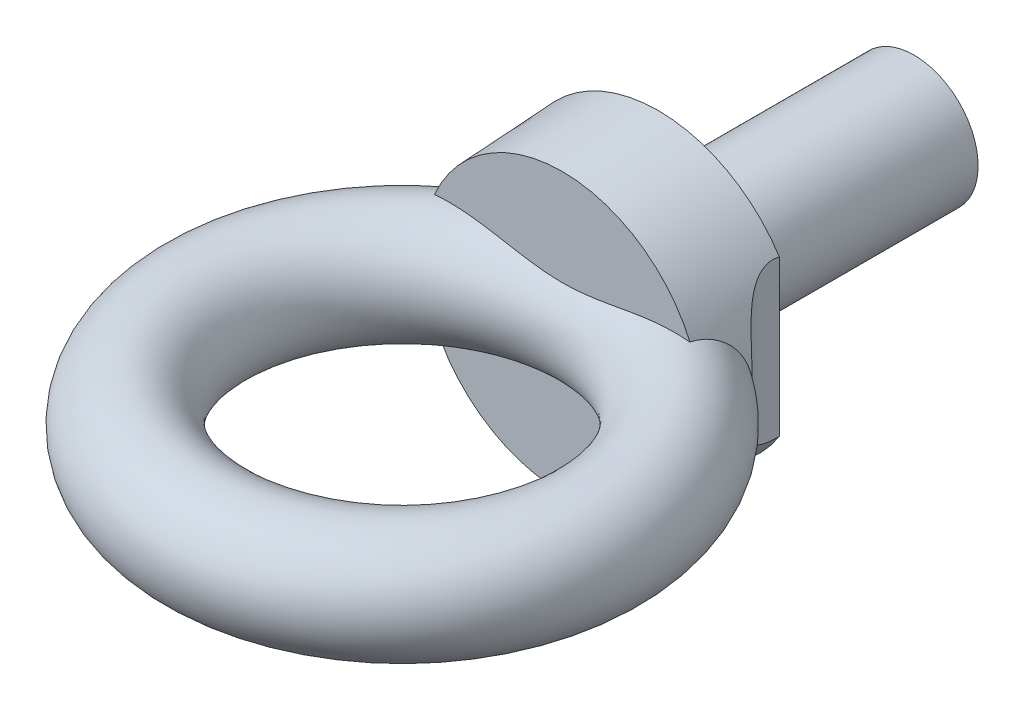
SolidWorks part; units mm, degrees
ref_plane "Front" through (0, 0, 0) normal (0, 0, 1) x (1, 0, 0)
ref_plane "Top" through (0, 0, 0) normal (0, 1, 0) x (1, 0, 0)
ref_plane "Right" through (0, 0, 0) normal (1, 0, 0) x (0, 0, -1)
sketch "Sketch1" plane through (0, 0, 0) normal (0, 1, 0) x (1, 0, 0)
  line L0 (0, 0) -> (0, -28.7808) construction
  line L2 (0, 0) -> (0, 32)
  line L3 (0, 32) -> (8, 32)
  line L4 (8, 0) -> (8, 32)
  line L5 (8, 0) -> (18, 0)
  line L6 (0, 0) -> (0, -12)
  line L7 (0, -12) -> (17.4, -12)
  line L8 (18, 0) -> (17.4, -12)
revolve "Revolve1" add sketch "Sketch1" angle 360 about L0
ref_plane "Plane1" through (0, 0, 32) normal (0, 0, 1) x (1, 0, 0)
sketch "Sketch2" plane through (0, 0, 32) normal (0, 0, 1) x (1, 0, 0)
  line L0 (0, 0) -> (0, -22.4554) construction
  line L1 (-17.5, 0) -> (-17.5, -15.5222) construction
  line L3 (-31.5, 0) -> (-31.5, -14.5749) construction
  circle A0 centre (-24.5, 0) radius 7
  dimension "D1" = 63
  dimension "D2" = 35
revolve "Revolve2" add sketch "Sketch2" angle 360 about L0
sketch "Эскиз1" plane through (0, 0, 0) normal (0, 1, 0) x (1, 0, 0)
  line L1 (0, 0) -> (0, -23.4667) construction
  line L2 (8, 0) -> (-8, 0) construction
  line L4 (18, 0) -> (-18, 0) construction
  line L5 (-17.7027, -5.945) -> (-18, 0)
  line L6 (-18, 0) -> (-15.1556, 0)
  line L7 (17.7027, -5.945) -> (18, 0)
  line L8 (18, 0) -> (15.1556, 0)
  arc A0 (-17.7027, -5.945) -> (-15.1556, 0) centre (-21.0747, -0.9822) ccw
  arc A1 (17.7027, -5.945) -> (15.1556, 0) centre (21.0747, -0.9822) cw
  arc A2 (-17.7027, -5.945) -> (17.7027, -5.945) centre (0, -32) ccw construction
  dimension "R1" = 6
extrude "Вырез-Вытянуть1" cut sketch "Эскиз1" against normal mid plane 300
equation "\"D1@Sketch1\" = \"D4@Sketch1\" - \"H1@Sketch1\" / 10"
